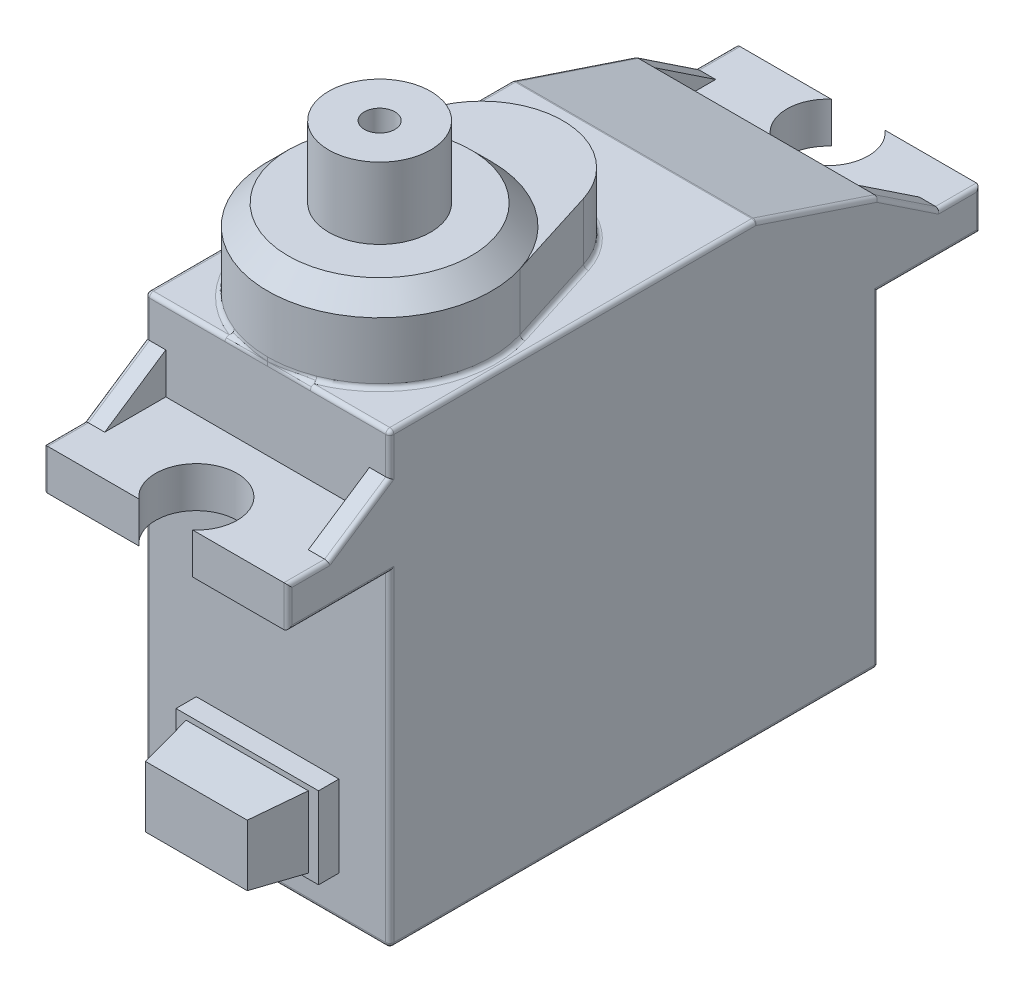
SolidWorks part; units mm, degrees
ref_plane "前视基准面" through (0, 0, 0) normal (0, 0, 1) x (1, 0, 0)
ref_plane "上视基准面" through (0, 0, 0) normal (0, 1, 0) x (1, 0, 0)
ref_plane "右视基准面" through (0, 0, 0) normal (1, 0, 0) x (0, 0, -1)
sketch "草图1" plane through (0, 0, 0) normal (0, 1, 0) x (1, 0, 0)
  line L0 (6, 12) -> (6, -12)
  line L1 (6, 12) -> (-6, 12)
  line L2 (6, -12) -> (-6, -12)
  line L3 (-6, 12) -> (-6, -12)
  line L4 (6, 12) -> (-6, -12) construction
  line L5 (6, -12) -> (-6, 12) construction
  point P1 (0, 0)
  dimension "D1" = 24
  dimension "D2" = 12
extrude "凸台-拉伸1" add sketch "草图1" along normal blind 16
sketch "草图2" plane through (6, 0, 0) normal (1, 0, 0) x (0, 0, -1)
  line L0 (-12, 16) -> (-17, 16)
  line L1 (-17, 16) -> (-17, 18)
  line L2 (-17, 18) -> (-12, 18)
  line L3 (-12, 18) -> (-12, 22)
  line L4 (-12, 22) -> (6, 22)
  line L5 (6, 22) -> (12, 20)
  line L6 (12, 18) -> (17, 18)
  line L7 (17, 18) -> (17, 16)
  line L8 (17, 16) -> (12, 16)
  line L9 (12, 16) -> (-12, 16)
  line L10 (12, 20) -> (12, 18)
  dimension "D1" = 5
  dimension "D2" = 5
  dimension "D3" = 2
  dimension "D4" = 2
  dimension "D5" = 5
  dimension "D6" = 5
  dimension "D7" = 4
  dimension "D8" = 18
  dimension "D9" = 2
extrude "凸台-拉伸2" add sketch "草图2" against normal blind 12
sketch "草图3" plane through (6, 0, 0) normal (1, 0, 0) x (0, 0, -1)
  line L0 (-12, 18) -> (-15, 18)
  line L1 (-12, 18) -> (-17, 18) construction
  line L2 (-15, 18) -> (-12, 20)
  line L3 (-12, 22) -> (-12, 18) construction
  line L4 (-12, 20) -> (-12, 18)
  dimension "D1" = 2
  dimension "D2" = 3
extrude "凸台-拉伸3" add sketch "草图3" against normal blind 1
mirror "镜向1" about plane through (0, 0, 0) normal (1, 0, 0) of "凸台-拉伸3"
mirror "镜向2" about plane through (0, 0, 0) normal (0, 0, 1) of "镜向1", "凸台-拉伸3"
sketch "草图4" plane through (0, 18, 0) normal (0, 1, 0) x (1, 0, 0)
  line L0 (0, 0) -> (0, -15.5) construction
  circle A0 centre (0, -15.5) radius 2
  dimension "D2" = 4
  dimension "D1" = 15.5
extrude "切除-拉伸1" cut sketch "草图4" against normal through all
mirror "镜向3" about plane through (0, 0, 0) normal (0, 0, 1) of "切除-拉伸1"
sketch "草图5" plane through (0, 22, 0) normal (0, 1, 0) x (1, 0, 0)
  line L0 (0, 0) -> (0, -1.5) construction
  line L1 (0, -1.5) -> (0, -6.5) construction
  line L2 (-3.8158, -0.3) -> (-5.2467, -4.85)
  line L3 (3.8158, -0.3) -> (5.2467, -4.85)
  arc A0 (-5.2467, -4.85) -> (5.2467, -4.85) centre (0, -6.5) ccw
  arc A1 (3.8158, -0.3) -> (-3.8158, -0.3) centre (0, -1.5) ccw
  dimension "D2" = 5
  dimension "D3" = 11
  dimension "D4" = 8
  dimension "D1" = 1.5
extrude "凸台-拉伸4" add sketch "草图5" along normal blind 3
sketch "草图6" plane through (0, 25, 0) normal (0, 1, 0) x (1, 0, 0)
  line L0 (0, 0) -> (0, -6.5) construction
  circle A0 centre (0, -6.5) radius 5.5
  dimension "D2" = 11
  dimension "D1" = 6.5
extrude "凸台-拉伸5" add sketch "草图6" along normal blind 1
chamfer "倒角1" distance 1 angle 45 1 edges at (0, 26, 12)
sketch "草图7" plane through (0, 26, 0) normal (0, 1, 0) x (1, 0, 0)
  circle A0 centre (0, -6.5) radius 2.5
  circle A1 centre (0, -6.5) radius 0.75
  dimension "D1" = 5
  dimension "D2" = 1.5
extrude "凸台-拉伸6" add sketch "草图7" along normal blind 3.5
sketch "草图8" plane through (0, 0, 12) normal (0, 0, 1) x (1, 0, 0)
  line L0 (0, 0) -> (0, 4) construction
  line L1 (3.5, 2) -> (3.5, 6)
  line L2 (3.5, 2) -> (-3.5, 2)
  line L3 (3.5, 6) -> (-3.5, 6)
  line L4 (-3.5, 2) -> (-3.5, 6)
  line L5 (3.5, 2) -> (-3.5, 6) construction
  line L6 (3.5, 6) -> (-3.5, 2) construction
  dimension "D1" = 4
  dimension "D2" = 7
  dimension "D3" = 4
extrude "凸台-拉伸7" add sketch "草图8" along normal blind 1
sketch "草图9" plane through (0, 0, 13) normal (0, 0, 1) x (1, 0, 0)
  line L0 (0, 0) -> (0, 4) construction
  line L1 (3, 2.25) -> (3, 5.75)
  line L2 (3, 2.25) -> (-3, 2.25)
  line L3 (3, 5.75) -> (-3, 5.75)
  line L4 (-3, 2.25) -> (-3, 5.75)
  line L5 (3, 2.25) -> (-3, 5.75) construction
  line L6 (3, 5.75) -> (-3, 2.25) construction
  dimension "D1" = 4
  dimension "D2" = 3.5
  dimension "D3" = 6
ref_plane "基准面1" through (0, 0, 15.5) normal (0, 0, 1) x (1, 0, 0)
sketch "草图10" plane through (0, 0, 15.5) normal (0, 0, 1) x (1, 0, 0)
  line L0 (0, 0) -> (0, 4) construction
  line L1 (2.5, 2.5) -> (2.5, 5.5)
  line L2 (2.5, 2.5) -> (-2.5, 2.5)
  line L3 (2.5, 5.5) -> (-2.5, 5.5)
  line L4 (-2.5, 2.5) -> (-2.5, 5.5)
  line L5 (2.5, 2.5) -> (-2.5, 5.5) construction
  line L6 (2.5, 5.5) -> (-2.5, 2.5) construction
  dimension "D1" = 3
  dimension "D2" = 5
loft "放样1" add profiles "草图9", "草图10"
fillet "圆角1" radius 0.2 40 edges at (3, 22, 12) (4.4342, 22, 9.7538) (0, 22, -2.5) (-4.5312, 22, 2.575) (-4.4342, 22, 9.7538) (4.5312, 22, 2.575) (-6, 17, 17) (-6, 21, 12) (-6, 22, 3) (-3, 22, 12) (-6, 21, -9) (0, 22, -6) (-6, 18, -16) (-6, 17, -17) (6, 17, -17) (6, 18, -16) (6, 21, -9) (6, 22, 3) (6, 21, 12) (6, 17, 17) (6, 0, 0) (6, 18, 16) (0, 0, 12) (6, 19, 13.5) (-6, 0, 0) (0, 0, -12) (-6, 18, 16) (-6, 19, 13.5) (6, 19, -13.5) (-6, 19, -13.5)
